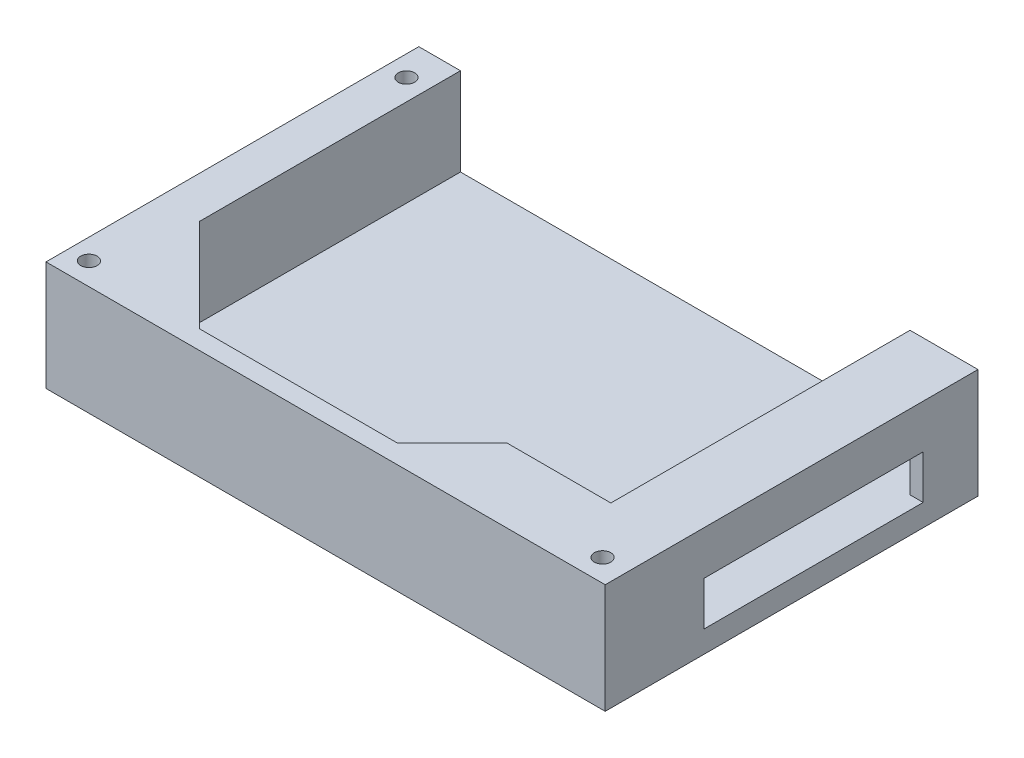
SolidWorks part; units mm, degrees
ref_plane "Front Plane" through (0, 0, 0) normal (0, 0, 1) x (1, 0, 0)
ref_plane "Top Plane" through (0, 0, 0) normal (0, 1, 0) x (1, 0, 0)
ref_plane "Right Plane" through (0, 0, 0) normal (1, 0, 0) x (0, 0, -1)
sketch "Sketch1" plane through (0, 0, 0) normal (0, 1, 0) x (1, 0, 0)
  line L0 (0, 0) -> (102, 0)
  line L1 (102, 0) -> (102, 68)
  line L2 (102, 68) -> (0, 68)
  line L3 (0, 68) -> (0, 0)
  dimension "D1" = 102
  dimension "D2" = 68
extrude "Boss-Extrude1" add sketch "Sketch1" along normal blind 20
sketch "Sketch3" plane through (0, 20, 0) normal (0, 1, 0) x (1, 0, 0)
  line L0 (16.6022, 61.4315) -> (85.6022, 61.4315)
  line L1 (85.6022, 61.4315) -> (99.6022, 47.4315)
  line L2 (99.6022, 47.4315) -> (99.6022, 19.4315)
  line L3 (99.6022, 19.4315) -> (93.6022, 13.4315)
  line L4 (93.6022, 13.4315) -> (70.6022, 13.4315)
  line L5 (93.6022, 13.4315) -> (70.6022, 13.4315) construction
  line L6 (70.6022, 13.4315) -> (60.6022, 3.4315)
  line L7 (16.6022, 61.4315) -> (7.6022, 54.4315)
  line L8 (7.6022, 54.4315) -> (7.6022, 20.4315)
  line L9 (7.6022, 20.4315) -> (24.6022, 3.4315)
  line L10 (24.6022, 3.4315) -> (60.6022, 3.4315)
extrude "Cut-Extrude1" cut sketch "Sketch3" against normal blind 16 and the other way through all
sketch "Sketch5" plane through (0, 20, 0) normal (0, 1, 0) x (1, 0, 0)
  line L0 (7.6022, 20.4315) -> (7.6022, 54.4315) construction
  line L1 (99.6022, 47.4315) -> (7.6022, 47.4315)
  line L2 (99.6022, 47.4315) -> (99.6022, 68)
  line L3 (99.6022, 68) -> (7.6022, 68)
  line L4 (7.6022, 47.4315) -> (7.6022, 68)
  line L5 (102, 68) -> (0, 68) construction
extrude "Cut-Extrude2" cut sketch "Sketch5" against normal blind 16
sketch "Sketch6" plane through (0, 20, 0) normal (0, 1, 0) x (1, 0, 0)
  line L0 (93.6022, 13.4315) -> (70.6022, 13.4315) construction
  line L1 (99.6022, 68) -> (89.6022, 68)
  line L2 (99.6022, 68) -> (99.6022, 13.4315)
  line L3 (99.6022, 13.4315) -> (89.6022, 13.4315)
  line L4 (89.6022, 68) -> (89.6022, 13.4315)
  dimension "D1" = 10
extrude "Boss-Extrude2" add sketch "Sketch6" against normal blind 8
sketch "Sketch9" plane through (102, 0, 0) normal (1, 0, 0) x (0, 0, -1)
  line L0 (68, 20) -> (68, 0) construction
  line L1 (58, 12) -> (18, 12)
  line L2 (58, 12) -> (58, 4)
  line L3 (58, 4) -> (18, 4)
  line L4 (18, 12) -> (18, 4)
  line L5 (0, 20) -> (68, 20) construction
  dimension "D1" = 8
  dimension "D2" = 8
  dimension "D3" = 50
  dimension "D4" = 10
extrude "Cut-Extrude3" cut sketch "Sketch9" against normal blind 8
sketch "Sketch10" plane through (0, 20, 0) normal (0, 1, 0) x (1, 0, 0)
  line L1 (0, 68) -> (0, 0) construction
  line L2 (7.6022, 68) -> (0, 68) construction
  circle A0 centre (3.75, 62) radius 1.5
  circle A1 centre (3.75, 4.0762) radius 1.5
  circle A2 centre (97.4419, 4.0762) radius 1.5
  point P6 (3.5256, 4.0762)
  point P11 (3.75, 4.0762)
  point P12 (97.4419, 4.0762)
  dimension "D1" = 3
  dimension "D2" = 3
  dimension "D3" = 3
  dimension "D4" = 3.75
  dimension "D5" = 6
extrude "Cut-Extrude4" cut sketch "Sketch10" against normal through all
